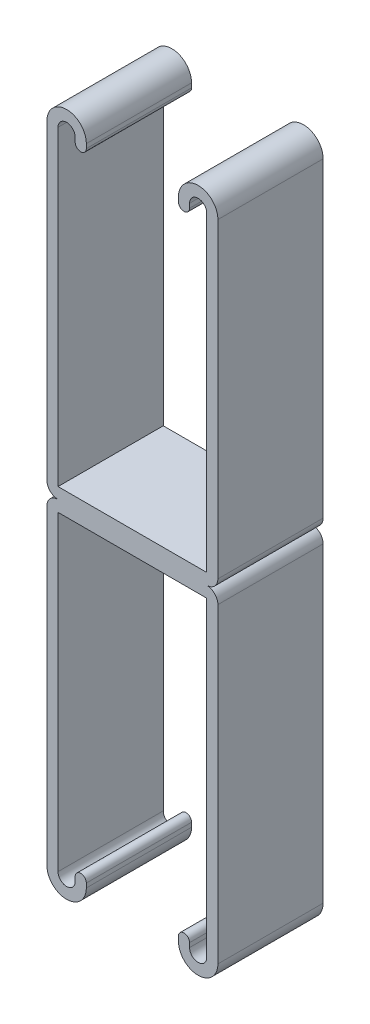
SolidWorks part; units mm, degrees
ref_plane "Plane1" through (0, 0, 0) normal (0, 0, 1) x (1, 0, 0)
ref_plane "Plane2" through (0, 0, 0) normal (0, 1, 0) x (1, 0, 0)
ref_plane "Plane3" through (0, 0, 0) normal (1, 0, 0) x (0, 0, -1)
sketch "Sketch1" plane through (0, 0, 0) normal (0, 0, 1) x (1, 0, 0)
  line L0 (-20.6375, 77.7875) -> (-20.6375, 2.6924)
  line L1 (-17.9451, 0) -> (17.9451, 0)
  line L2 (20.6375, 2.6924) -> (20.6375, 77.7875)
  line L3 (11.1125, 77.7875) -> (11.1125, 76.7524)
  line L4 (-11.1125, 77.7875) -> (-11.1125, 76.7524)
  line L5 (-13.8049, 77.7875) -> (-13.8049, 76.7524)
  line L6 (-17.9451, 77.7875) -> (-17.9451, 2.6924)
  line L7 (-17.9451, 2.6924) -> (17.9451, 2.6924)
  line L8 (17.9451, 2.6924) -> (17.9451, 77.7875)
  line L9 (13.8049, 77.7875) -> (13.8049, 76.7524)
  line L10 (-25.4, 82.55) -> (25.4, 82.55) construction
  line L11 (-12.8524, 75.4062) -> (12.8524, 75.4062) construction
  arc A0 (20.6375, 77.7875) -> (11.1125, 77.7875) centre (15.875, 77.7875) ccw
  arc A1 (-20.6375, 77.7875) -> (-11.1125, 77.7875) centre (-15.875, 77.7875) cw
  arc A2 (-17.9451, 0) -> (-20.6375, 2.6924) centre (-17.9451, 2.6924) cw
  arc A3 (17.9451, 0) -> (20.6375, 2.6924) centre (17.9451, 2.6924) ccw
  arc A4 (-17.9451, 77.7875) -> (-13.8049, 77.7875) centre (-15.875, 77.7875) cw
  arc A5 (17.9451, 77.7875) -> (13.8049, 77.7875) centre (15.875, 77.7875) ccw
  arc A6 (11.1125, 76.7524) -> (13.8049, 76.7524) centre (12.4587, 76.7524) ccw
  arc A7 (-11.1125, 76.7524) -> (-13.8049, 76.7524) centre (-12.4587, 76.7524) cw
  dimension "D1" = 2.6924
  dimension "Width" = 41.275
  dimension "D6" = 9.525
  dimension "D7" = 22.225
  dimension "D9" = 7.1437
  dimension "D2" = 82.55
  dimension "gauge" = 2.6924
extrude "Base-Extrude" add sketch "Sketch1" along normal mid plane 25.4
mirror "Mirror1" about plane through (0, 0, 0) normal (0, 1, 0) of "Base-Extrude"
equation "\"D7@Sketch1\" = \"Width@Sketch1\" - 2 * \"D6@Sketch1\""
equation "\"D1@Sketch1\" = \"gauge@Sketch1\""
